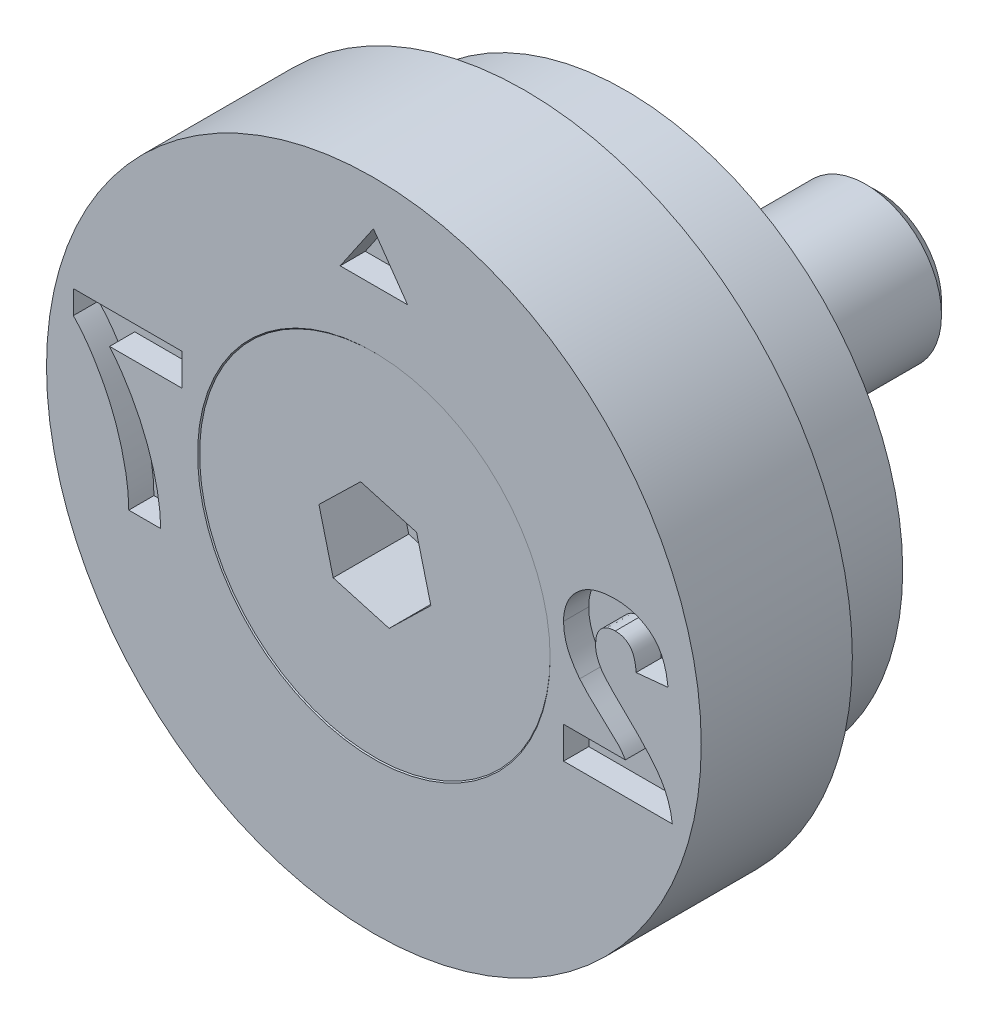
SolidWorks part; units mm, degrees
other "<M3 X .5 FHCS>-<Imported1>"
ref_plane "Front Plane" through (0, 0, 0) normal (0, 0, 1) x (1, 0, 0)
ref_plane "Top Plane" through (0, 0, 0) normal (0, 1, 0) x (1, 0, 0)
ref_plane "Right Plane" through (0, 0, 0) normal (1, 0, 0) x (0, 0, -1)
imported_body "Imported1"
sketch "Sketch1" plane through (0, 0, 0) normal (0, 0, 1) x (1, 0, 0)
  text T0 "2      7" font "Arial" height 3.302
  dimension "D1" = 1.651
extrude "Cut-Extrude1" cut sketch "Sketch1" against normal blind 0.5
inserted part "M3 X .5 FHCS"
move or copy body "Body-Move/Copy2" placed by mates yes
